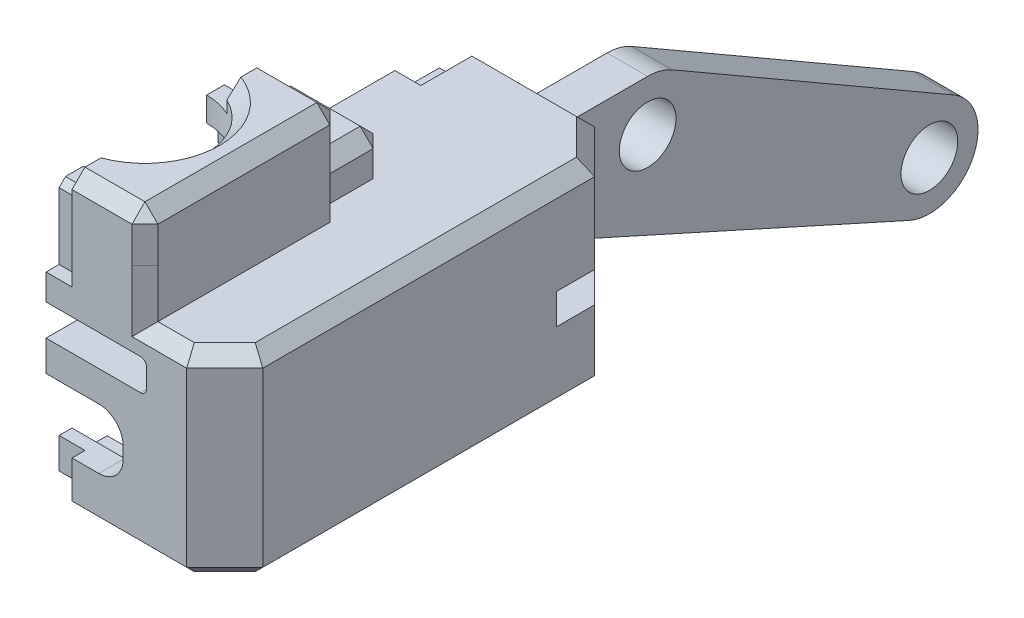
SolidWorks part; units mm, degrees
ref_plane "Front Plane" through (0, 0, 0) normal (0, 0, 1) x (1, 0, 0)
ref_plane "Top Plane" through (0, 0, 0) normal (0, 1, 0) x (1, 0, 0)
ref_plane "Right Plane" through (0, 0, 0) normal (1, 0, 0) x (0, 0, -1)
imported_body "Right (Open).ipt<1>"
sketch "Sketch1" plane through (0, 0, -11.6367) normal (0, 0, -1) x (-1, 0, 0)
  line L0 (-1.52, 43.1225) -> (-1.52, 47.2529) construction
  line L1 (-2.52, 45.88) -> (-5.02, 45.88)
  line L2 (-2.52, 45.88) -> (-2.52, 39.65)
  line L3 (-2.52, 39.65) -> (-5.02, 39.65)
  line L4 (-5.02, 45.88) -> (-5.02, 39.65)
  line L5 (-7.9657, 36.65) -> (-1.52, 36.65) construction
  point P6 (-1.52, 45.1877)
  dimension "D1" = 6.23
  dimension "D2" = 2.5
  dimension "D3" = 1
  dimension "D4" = 3
extrude "Boss-Extrude1" add sketch "Sketch1" along normal blind 9.54
fillet "Fillet1" radius 3 2 edges at (3.77, 45.88, -21.1767) (3.77, 39.65, -21.1767)
hole_wizard "Ø3.5 (3.5) Diameter Hole1" positions "Sketch2" profile "Sketch3" hole size "Ø3.5" standard "ANSI Metric"
sketch "Sketch2" plane through (2.52, 0, 0) normal (-1, 0, 0) x (0, 0, 1)
  line L0 (-18.1767, 45.88) -> (-18.1767, 39.65) construction
  point P0 (-18.1767, 42.765)
  point P11 (-18.1767, 42.765)
sketch "Sketch3" plane through (2.52, 42.765, -18.1767) normal (0, 1, 0) x (0, 0, 1)
  line L0 (0, 0) -> (0, 8.4214)
  line L1 (0, 8.4214) -> (1.75, 8.4214)
  line L2 (1.75, 8.4214) -> (1.75, 0)
  line L5 (1.75, 0) -> (0, 0)
  line L11 (0, -6.35) -> (0, 107.95) construction
  dimension "Thru Hole Dia." = 3.5
  dimension "Thru Hole Depth" = 8.4214
sketch "Sketch4" plane through (2.52, 0, 0) normal (-1, 0, 0) x (0, 0, 1)
  line L0 (-11.6367, 41.2725) -> (-11.6367, 43.1225) construction
  line L1 (-11.6367, 43.1225) -> (-13.6367, 43.1225)
  line L2 (-11.6367, 43.1225) -> (-11.6367, 41.2487)
  line L3 (-11.6367, 41.2487) -> (-13.6367, 41.2487)
  line L4 (-13.6367, 43.1225) -> (-13.6367, 41.2487)
  line L5 (-10.0414, 43.1225) -> (-7.2047, 43.1225) construction
  line L6 (-6.6367, 41.2487) -> (-7.2047, 41.2487) construction
  dimension "D1" = 2
extrude "Cut-Extrude1" cut sketch "Sketch4" against normal blind 5
sketch "Sketch5" plane through (0, 0, -11.6367) normal (0, 0, -1) x (-1, 0, 0)
  line L1 (-2.52, 45.88) -> (-0.92, 45.88)
  line L2 (-2.52, 45.88) -> (-2.52, 43.1225)
  line L3 (-2.52, 43.1225) -> (-0.92, 43.1225)
  line L4 (-0.92, 45.88) -> (-0.92, 43.1225)
  line L7 (-0.92, 41.2725) -> (-2.52, 41.2725)
  line L8 (-0.92, 41.2725) -> (-0.92, 39.65)
  line L9 (-0.92, 39.65) -> (-2.52, 39.65)
  line L10 (-2.52, 41.2725) -> (-2.52, 39.65)
  line L11 (-1.52, 41.2725) -> (0.08, 41.2725) construction
  line L12 (0.08, 41.2725) -> (0.08, 37.8521) construction
  line L13 (0.08, 43.1225) -> (-1.52, 43.1225) construction
  dimension "D1" = 1
extrude "Boss-Extrude2" add sketch "Sketch5" along normal blind 1.54
sketch "Sketch6" plane through (2.52, 0, 0) normal (-1, 0, 0) x (0, 0, 1)
  line L0 (-19.6767, 45.4781) -> (-37.0467, 35.4495)
  line L1 (-18.1767, 45.88) -> (-13.1767, 45.88) construction
  line L2 (-13.1767, 39.65) -> (-34.3133, 30.1167)
  line L8 (-13.1767, 39.65) -> (-13.1767, 41.2487)
  line L9 (-13.1767, 41.2487) -> (-13.6367, 41.2487)
  line L10 (-13.6367, 41.2487) -> (-13.6367, 43.1225)
  line L11 (-13.6367, 43.1225) -> (-13.1767, 43.1225)
  line L12 (-13.1767, 43.1225) -> (-13.1767, 45.88)
  line L13 (-13.1767, 45.88) -> (-18.1767, 45.88)
  line L14 (-21.1767, 42.88) -> (-21.1767, 42.65)
  line L15 (-18.1767, 39.65) -> (-13.1767, 39.65)
  line L22 (-21.1767, 42.88) -> (-21.1767, 42.65)
  line L23 (-18.1767, 39.65) -> (-13.1767, 39.65)
  arc A0 (-18.1767, 45.88) -> (-21.1767, 42.88) centre (-18.1767, 42.88) ccw construction
  arc A1 (-37.0467, 35.4495) -> (-34.3133, 30.1167) centre (-35.5467, 32.8514) ccw
  arc A2 (-18.1767, 45.88) -> (-21.1767, 42.88) centre (-18.1767, 42.88) ccw
  arc A3 (-21.1767, 42.65) -> (-18.1767, 39.65) centre (-18.1767, 42.65) ccw
  arc A4 (-19.6767, 45.4781) -> (-21.1767, 42.88) centre (-18.1767, 42.88) ccw
  arc A5 (-21.1767, 42.65) -> (-18.1767, 39.65) centre (-18.1767, 42.65) ccw
  circle A6 centre (-35.5467, 32.8514) radius 1.75
  circle A7 centre (-18.1767, 42.765) radius 1.75 construction
  dimension "D3" = 20
  dimension "D2" = 30
  dimension "D1" = 0
extrude "Boss-Extrude3" add sketch "Sketch6" against normal up to surface (2.5 mm away)
